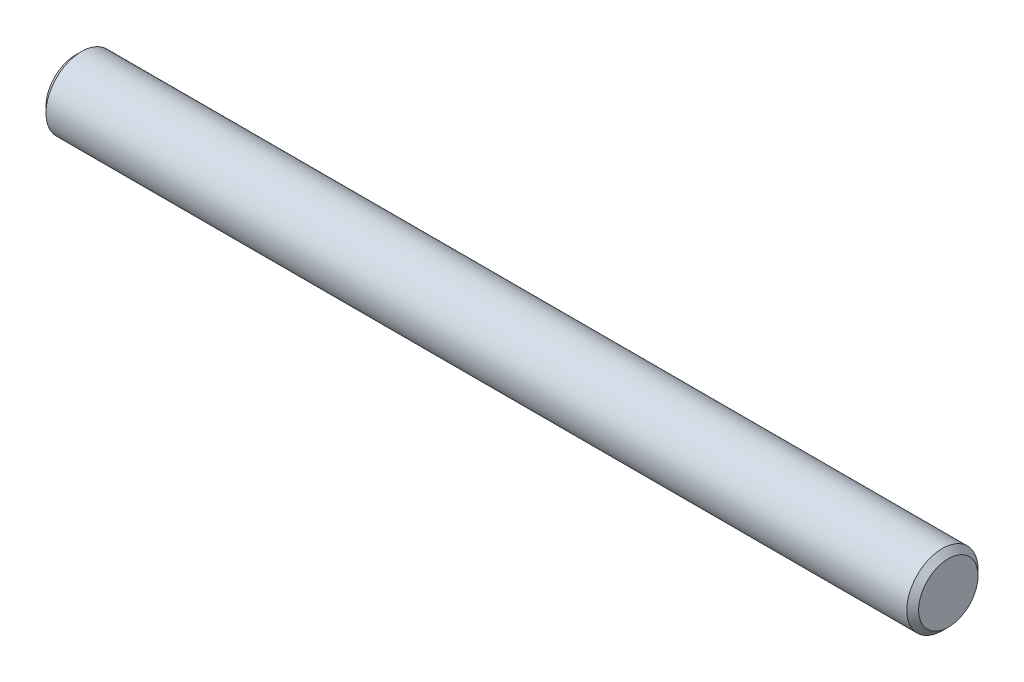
SolidWorks part; units mm, degrees
ref_plane "Front" through (0, 0, 0) normal (0, 0, 1) x (1, 0, 0)
ref_plane "Top" through (0, 0, 0) normal (0, 1, 0) x (1, 0, 0)
ref_plane "Right" through (0, 0, 0) normal (1, 0, 0) x (0, 0, -1)
sketch "Sketch1" plane through (0, 0, 0) normal (1, 0, 0) x (0, 0, -1)
  circle A0 centre (0, 0) radius 6
  dimension "D1" = 12
extrude "Extrude1" add sketch "Sketch1" along normal blind 147
chamfer "Chamfer1" distance 1 angle 45 2 edges at (0, 0, -6) (147, 0, -6)
